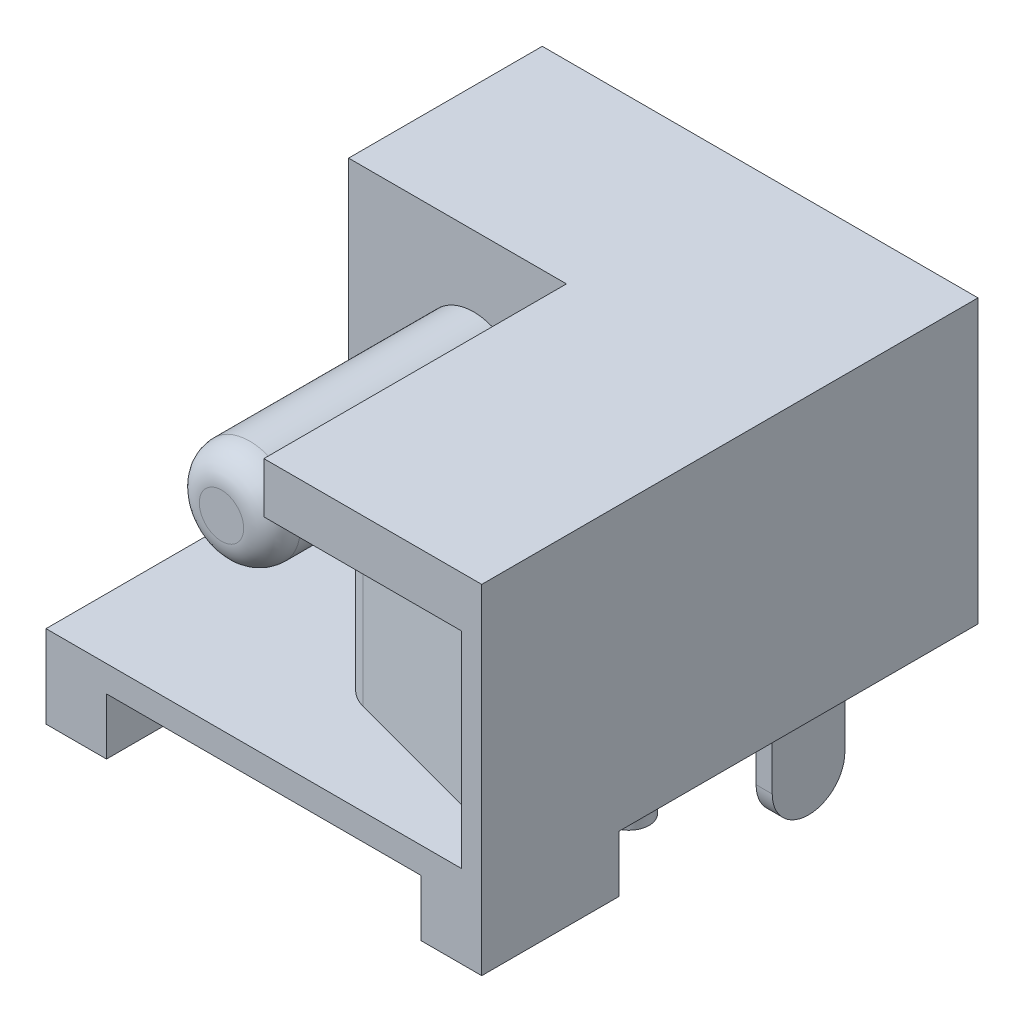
SolidWorks part; units mm, degrees
ref_plane "Front" through (0, 0, 0) normal (0, 0, 1) x (1, 0, 0)
ref_plane "Top" through (0, 0, 0) normal (0, 1, 0) x (1, 0, 0)
ref_plane "Right" through (0, 0, 0) normal (1, 0, 0) x (0, 0, -1)
imported_body "Импортированный1"
sketch "Эскиз1" plane through (0, 0, -12.3) normal (0, 0, -1) x (-1, 0, 0)
  line L0 (-0.3, -2) -> (-0.3, 0.8) construction
  line L1 (-0.7, 0.8) -> (-0.3, 0.8)
  line L2 (-0.7, 0.8) -> (-0.7, 0.79)
  line L3 (-0.7, 0.79) -> (-0.3, 0.79)
  line L4 (-0.3, 0.8) -> (-0.3, 0.79)
  dimension "D1" = 0.01
extrude "Вытянуть1" cut sketch "Эскиз1" against normal blind 0.01
